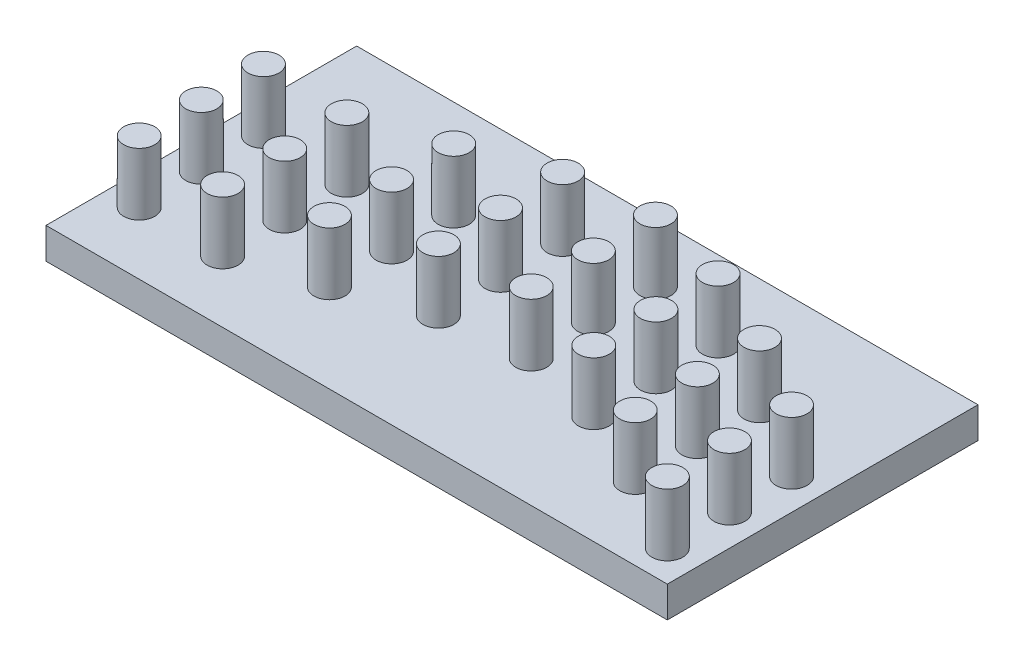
SolidWorks part; units mm, degrees
ref_plane "Front Plane" through (0, 0, 0) normal (0, 0, 1) x (1, 0, 0)
ref_plane "Top Plane" through (0, 0, 0) normal (0, 1, 0) x (1, 0, 0)
ref_plane "Right Plane" through (0, 0, 0) normal (1, 0, 0) x (0, 0, -1)
sketch "Sketch1" plane through (0, 0, 0) normal (0, 1, 0) x (1, 0, 0)
  line L1 (0, 0) -> (100, 0)
  line L2 (0, 0) -> (0, 50)
  line L3 (0, 50) -> (100, 50)
  line L4 (100, 0) -> (100, 50)
  dimension "D1" = 100
  dimension "D2" = 50
extrude "Extrude1" add sketch "Sketch1" along normal blind 5
sketch "Sketch5" plane through (0, 5, 0) normal (0, 1, 0) x (-1, 0, 0)
  line L0 (0, 0) -> (-100, 0) construction
  line L1 (-100, 0) -> (-100, -50) construction
  circle A0 centre (-95, -5) radius 2.5
  dimension "D1" = 5
  dimension "D2" = 5
  dimension "D3" = 5
extrude "Extrude2" add sketch "Sketch5" along normal blind 10
sketch "Sketch3" plane through (0, 5, 0) normal (0, 1, 0) x (-1, 0, 0)
  line L0 (0, -50) -> (0, 0) construction
  line L1 (0, 0) -> (-100, 0) construction
  spline S0 degree 3 poles (-95, -5) (-79.9009, -13.772) (-51.8892, -30.0458) (-22.0301, -7.0373) (-6.7497, -9.6956) (-5, -10) knots 0 0 0 0 0.508706 0.943742 1 1 1 1
  dimension "D1" = 5
  dimension "D2" = 10
pattern_curve "CrvPattern1" of "Extrude2" parameters "D1"=8, "D3"=50, "D2"=3, "D4"=10
